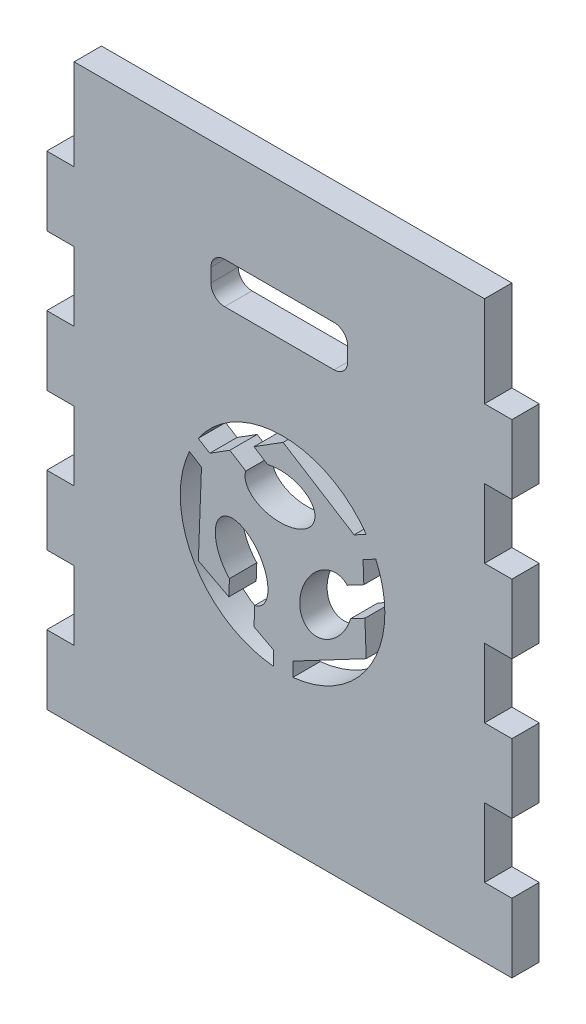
SolidWorks part; units mm, degrees
ref_plane "Front" through (0, 0, 0) normal (0, 0, 1) x (1, 0, 0)
ref_plane "Top" through (0, 0, 0) normal (0, 1, 0) x (1, 0, 0)
ref_plane "Right" through (0, 0, 0) normal (1, 0, 0) x (0, 0, -1)
sketch "Sketch1" plane through (0, 0, 0) normal (0, 0, 1) x (1, 0, 0)
  line L0 (-3.168, 46.75) -> (16.832, 46.75)
  line L2 (-3.168, 46.75) -> (-3.168, 97.25)
  line L3 (16.832, 466.75) -> (316.832, 466.75)
  line L4 (336.832, 46.75) -> (336.832, 97.25)
  line L5 (-3.168, 97.25) -> (16.832, 97.25)
  line L6 (-3.168, 147.75) -> (16.832, 147.75)
  line L7 (-3.168, 198.25) -> (16.832, 198.25)
  line L8 (-3.168, 248.75) -> (16.832, 248.75)
  line L9 (-3.168, 299.25) -> (16.832, 299.25)
  line L10 (-3.168, 349.75) -> (16.832, 349.75)
  line L11 (-3.168, 400.25) -> (16.832, 400.25)
  line L12 (316.832, 466.75) -> (316.832, 400.25)
  line L14 (16.832, 97.25) -> (16.832, 147.75)
  line L15 (-3.168, 147.75) -> (-3.168, 198.25)
  line L16 (16.832, 198.25) -> (16.832, 248.75)
  line L17 (-3.168, 248.75) -> (-3.168, 299.25)
  line L18 (16.832, 299.25) -> (16.832, 349.75)
  line L19 (-3.168, 349.75) -> (-3.168, 400.25)
  line L20 (16.832, 400.25) -> (16.832, 466.75)
  line L21 (316.832, 349.75) -> (336.832, 349.75)
  line L22 (316.832, 400.25) -> (336.832, 400.25)
  line L23 (316.832, 299.25) -> (336.832, 299.25)
  line L24 (316.832, 248.75) -> (336.832, 248.75)
  line L25 (316.832, 198.25) -> (336.832, 198.25)
  line L26 (316.832, 147.75) -> (336.832, 147.75)
  line L27 (316.832, 97.25) -> (336.832, 97.25)
  line L28 (316.832, 46.75) -> (336.832, 46.75)
  line L30 (336.832, 147.75) -> (336.832, 198.25)
  line L31 (316.832, 147.75) -> (316.832, 97.25)
  line L32 (336.832, 248.75) -> (336.832, 299.25)
  line L33 (316.832, 248.75) -> (316.832, 198.25)
  line L34 (336.832, 349.75) -> (336.832, 400.25)
  line L35 (316.832, 349.75) -> (316.832, 299.25)
  line L36 (16.832, 46.75) -> (316.832, 46.75)
  line L38 (17.032, -3.75) -> (357.032, -3.75)
  dimension "D1" = 420
  dimension "D2" = 300
extrude "Extrude1" add sketch "Sketch1" along normal blind 20
sketch "Sketch2" plane through (0, 0, 20) normal (0, 0, 1) x (1, 0, 0)
  line L1 (229.3951, 220.7976) -> (230.3419, 195.6345)
  line L2 (148.278, 288.8293) -> (169.5964, 302.2308)
  line L3 (107.5805, 273.757) -> (115.9412, 268.5012)
  line L4 (169.5964, 302.2308) -> (221.4903, 269.6084)
  line L5 (101.0904, 262.2588) -> (109.9261, 256.7044)
  line L7 (176.7346, 167.3167) -> (176.7346, 157.0046)
  line L8 (162.4845, 167.3616) -> (162.4845, 156.9257)
  line L9 (158.2911, 282.5346) -> (148.278, 288.8293)
  line L10 (130.655, 277.7508) -> (142.3121, 270.4227)
  line L11 (129.9194, 184.564) -> (107.6541, 196.3255)
  line L14 (221.4903, 269.6084) -> (230.4199, 274.3254)
  line L15 (228.6123, 241.5988) -> (216.4375, 235.1675)
  line L16 (148.3251, 174.8412) -> (148.8429, 188.6007)
  line L17 (115.9412, 268.5012) -> (130.655, 277.7508)
  line L18 (228.0238, 257.2403) -> (237.3469, 262.1652)
  line L21 (107.6541, 196.3255) -> (109.9261, 256.7044)
  line L23 (130.3641, 196.3829) -> (129.9194, 184.564)
  line L25 (228.0238, 257.2403) -> (228.6123, 241.5988)
  line L26 (230.3419, 195.6345) -> (176.7346, 167.3167)
  line L27 (162.4845, 167.3616) -> (148.3251, 174.8412)
  line L28 (218.9372, 215.2733) -> (229.3951, 220.7976)
  arc A0 (230.4199, 274.3254) -> (107.5805, 273.757) centre (169.1975, 231.397) ccw
  arc A1 (101.0904, 262.2588) -> (162.4845, 156.9257) centre (169.1975, 231.397) ccw
  arc A2 (176.7346, 157.0046) -> (237.3469, 262.1652) centre (169.1975, 231.397) ccw
  ellipse E1 centre (200.9812, 215.1957) end of major axis (188.1976, 193.0539) minor radius 16.5841 (216.4375, 235.1675) -> (218.9372, 215.2733) ccw
  ellipse E2 centre (139.275, 211.9721) end of major axis (152.0585, 189.8303) minor radius 16.5841 (148.8429, 188.6007) -> (130.3641, 196.3829) ccw
  ellipse E6 centre (167.3363, 267.0231) end of major axis (192.9035, 267.0231) minor radius 16.5841 (142.3121, 270.4227) -> (158.2911, 282.5346) ccw
extrude "Extrude2" cut sketch "Sketch2" along direction (0, 0, 1) on the side against the normal through all
sketch "Sketch3" plane through (0, 0, 20) normal (0, 0, 1) x (1, 0, 0)
  line L0 (166.832, 424.3964) -> (166.832, -25.6036) construction
  line L1 (126.832, 396.75) -> (206.832, 396.75)
  line L2 (116.832, 386.75) -> (116.832, 376.75)
  line L3 (126.832, 366.75) -> (206.832, 366.75)
  line L4 (216.832, 386.75) -> (216.832, 376.75)
  line L6 (336.832, 349.75) -> (336.832, 400.25) construction
  line L8 (316.832, 466.75) -> (16.832, 466.75) construction
  arc A0 (126.832, 396.75) -> (116.832, 386.75) centre (126.832, 386.75) ccw
  arc A1 (126.832, 366.75) -> (116.832, 376.75) centre (126.832, 376.75) cw
  arc A2 (216.832, 376.75) -> (206.832, 366.75) centre (206.832, 376.75) cw
  arc A3 (206.832, 396.75) -> (216.832, 386.75) centre (206.832, 386.75) cw
  dimension "D2" = 10
  dimension "D1" = 50
  dimension "D4" = 70
  dimension "D3" = 170
  dimension "D5" = 100
  dimension "D6" = 100
extrude "Extrude3" cut sketch "Sketch3" against normal through all
